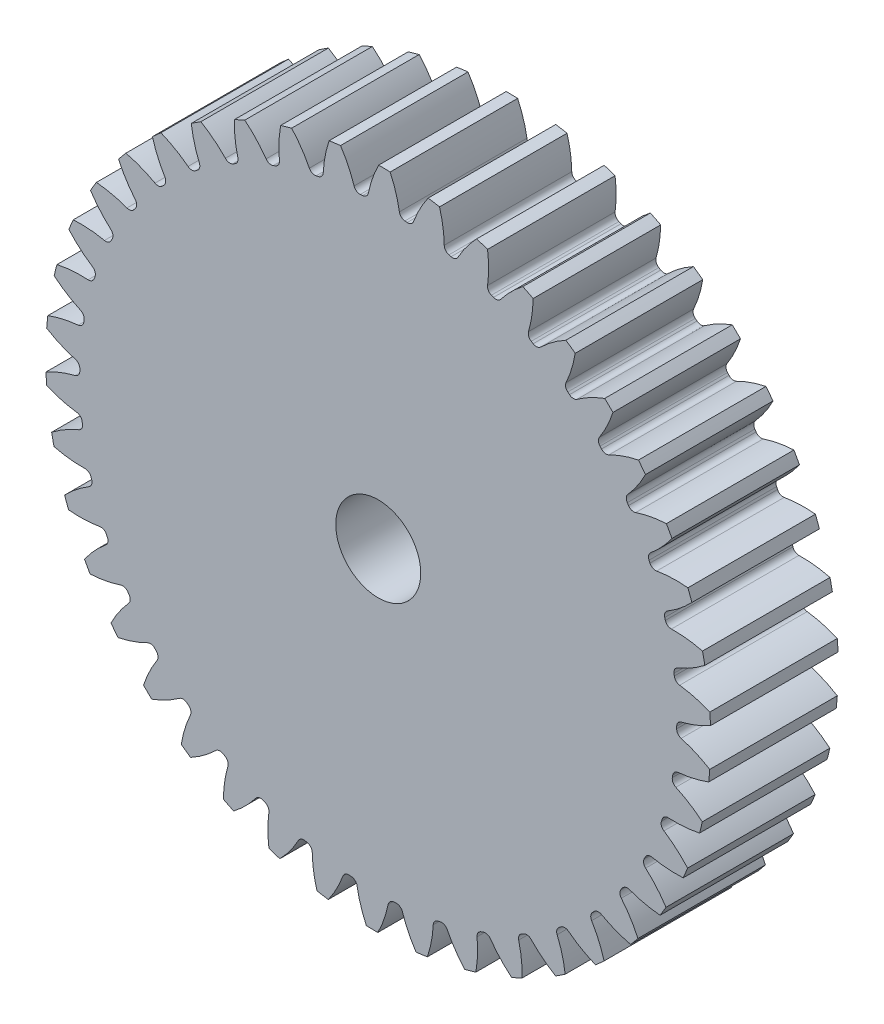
SolidWorks part; units mm, degrees
ref_plane "Front" through (0, 0, 0) normal (0, 0, 1) x (1, 0, 0)
ref_plane "Top" through (0, 0, 0) normal (0, 1, 0) x (1, 0, 0)
ref_plane "Right" through (0, 0, 0) normal (1, 0, 0) x (0, 0, -1)
sketch "Sketch3" plane through (0, 0, 0) normal (0, 0, 1) x (1, 0, 0)
  circle A0 centre (0, 0) radius 248.3556
  dimension "od" = 496.7111
extrude "gearBody" add sketch "Sketch3" along normal blind 95.25
sketch "Sketch2" plane through (0, 0, 0) normal (0, 0, 1) x (1, 0, 0)
  line L0 (0, 0) -> (205.8125, 85.2503) construction
  line L1 (247.823, -18.9781) -> (0, 0) construction
  line L2 (0, 0) -> (36.3143, 0) construction
  line L3 (237.025, 4.4453) -> (236.6981, -13.2144) construction
  line L5 (236.8615, -4.3846) -> (0, 0) construction
  line L7 (0, 0) -> (222.7698, 0) construction
  arc A0 (222.7696, 0.3025) -> (222.6058, -8.5469) centre (0, 0) ccw construction
  arc A1 (248.1666, 9.6871) -> (247.638, -18.865) centre (0, 0) ccw construction
  arc A2 (237.025, 4.4453) -> (236.6981, -13.2144) centre (0, 0) ccw construction
  arc A3 (222.9001, -4.9743) -> (222.9314, -3.2785) centre (0, 0) ccw
  arc A4 (247.823, -18.9781) -> (226.2354, -9.4958) centre (202.5164, -92.8089) ccw
  arc A5 (247.823, -18.9781) -> (248.3556, 9.7933) centre (0, 0) ccw
  arc A6 (248.3556, 9.7933) -> (226.4319, 1.1164) centre (205.8125, 85.2503) cw
  arc A7 (222.9314, -3.2785) -> (226.4319, 1.1164) centre (227.5255, -3.3461) cw
  arc A8 (226.2354, -9.4958) -> (222.9001, -4.9743) centre (227.4935, -5.0768) cw
  point P6 (248.3556, 9.7933)
  point P22 (247.823, -18.9781)
  dimension "baseDia" = 445.5396
  dimension "od" = 496.7111
  dimension "pd" = 474.1333
  dimension "rd" = 445.9111
  dimension "rFillet" = 4.5946
  dimension "pointX" = 248.3556
  dimension "pointY" = 9.7933
  dimension "CTT" = 17.6597
  dimension "flankCenterAngle" = 22.5
extrude "toothCut" cut sketch "Sketch2" along normal through all
pattern_circular "CirPattern1" count 42 over 360 about axis through (0, 0, 0) along (0, 0, 1) of "toothCut"
sketch "hub1Dia" plane through (0, 0, 0) normal (0, 0, -1) x (-1, 0, 0)
  circle A0 centre (0, 0) radius 12.7
  dimension "hub1Dia" = 25.4
sketch "hub2Dia" plane through (0, 0, 95.25) normal (0, 0, 1) x (1, 0, 0)
  circle A0 centre (0, 0) radius 12.7
  dimension "hub2dia" = 25.4
sketch "boreDia" plane through (0, 0, 0) normal (0, 0, 1) x (1, 0, 0)
  circle A0 centre (0, 0) radius 31.75
  dimension "boreDia" = 63.5
extrude "bore" cut sketch "boreDia" against normal mid plane 25400
